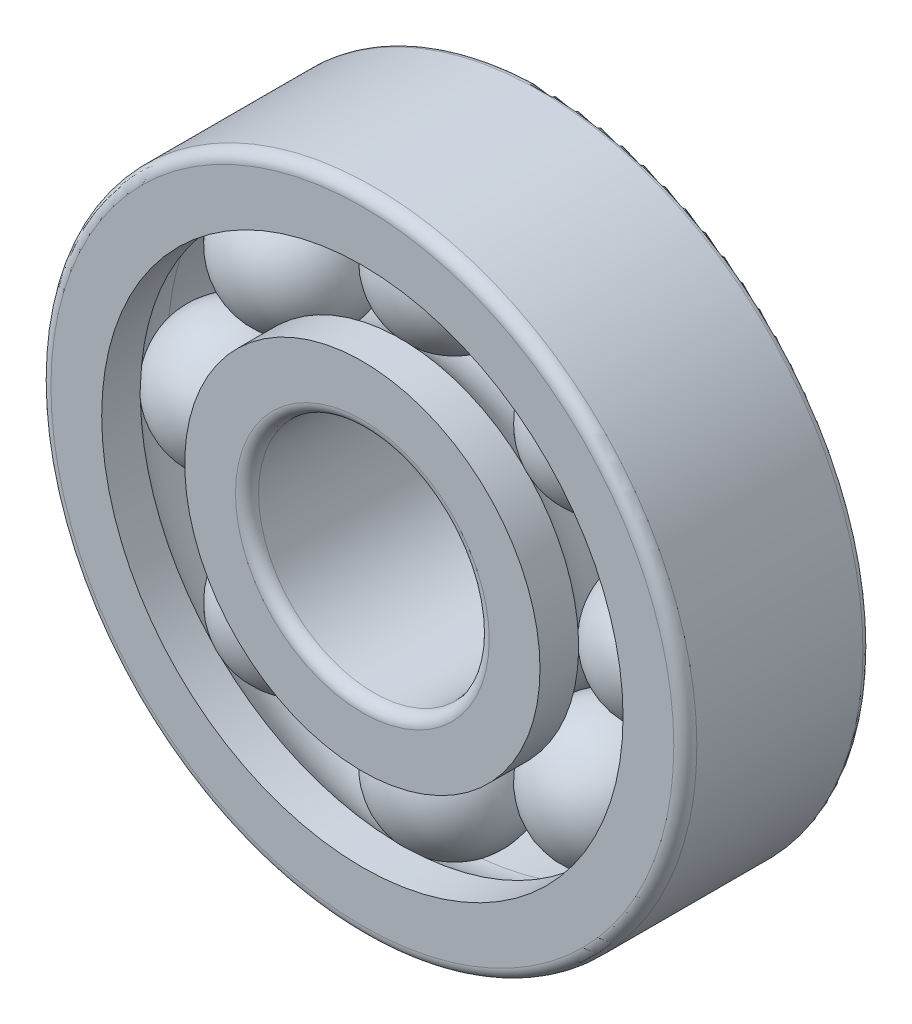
SolidWorks part; units mm, degrees
ref_plane "Front Plane" through (0, 0, 0) normal (0, 0, 1) x (1, 0, 0)
ref_plane "Top Plane" through (0, 0, 0) normal (0, 1, 0) x (1, 0, 0)
ref_plane "Right Plane" through (0, 0, 0) normal (1, 0, 0) x (0, 0, -1)
sketch "BaseSke" plane through (0, 0, 0) normal (1, 0, 0) x (0, 0, -1)
  line L0 (-47.2296, 0) -> (24.6132, 0) construction
  line L1 (-47.2296, 9.5) -> (24.6132, 9.5) construction
  line L2 (0, 129.5214) -> (0, -86.3012) construction
  line L3 (0, 12.45) -> (0, 6.55)
  line L4 (-4, 14) -> (4, 14) construction
  line L5 (-4, 5) -> (4, 5) construction
  arc A0 (0, 12.45) -> (0, 6.55) centre (0, 9.5) ccw
  dimension "D1" = 9.5
  dimension "Bearing_Thickness" = 8
  dimension "Bearing_Outside_Diameter" = 28
  dimension "Bearing_Inside_Diameter" = 10
  dimension "Ball_Outer_Diameter" = 24.9
revolve "Ball" add sketch "BaseSke" angle 360 about L3
sketch "OuterRaceSke" plane through (0, 0, 0) normal (1, 0, 0) x (0, 0, -1)
  line L0 (0, 0) -> (0, 87.5396) construction
  line L1 (-4, 14) -> (4, 14)
  line L2 (-4, 14) -> (-4, 11.3)
  line L3 (-4, 11.3) -> (-2.3246, 11.3)
  line L4 (4, 14) -> (4, 12.44)
  line L5 (-50.3916, 0) -> (55.2197, 0) construction
  line L6 (-47.2296, 9.5) -> (24.6132, 9.5) construction
  line L7 (0, 12.44) -> (4, 12.44)
  arc A0 (0, 12.44) -> (-2.3246, 11.3) centre (0, 9.5) ccw
  dimension "D2" = 24.88
  dimension "Inner_diameter" = 22.6
revolve "OuterRace" add sketch "OuterRaceSke" angle 360 about L5
sketch "InnerRaceSke" plane through (0, 0, 0) normal (1, 0, 0) x (0, 0, -1)
  line L0 (-70.8626, 0) -> (113.5527, 0) construction
  line L1 (0, 58.441) -> (0, -70.8113) construction
  line L2 (-4, 5) -> (4, 5)
  line L3 (-4, 5) -> (-4, 7.7)
  line L4 (-4, 7.7) -> (-2.3246, 7.7)
  line L5 (4, 5) -> (4, 7.7)
  line L6 (0, 129.5214) -> (0, -86.3012) construction
  line L7 (2.3246, 7.7) -> (4, 7.7)
  line L8 (-4, 14) -> (-4, 11.3) construction
  arc A0 (-2.3246, 7.7) -> (2.3246, 7.7) centre (0, 9.5) ccw
  arc A1 (0, 12.45) -> (0, 6.55) centre (0, 9.5) ccw construction
  arc A2 (0, 12.44) -> (-2.3246, 11.3) centre (0, 9.5) ccw construction
revolve "InnerRace" add sketch "InnerRaceSke" angle 360 about L0
fillet "Fillet1" radius 0.5 3 edges at (5, 0, -4) (5, 0, 4) (14, 0, 4)
fillet "Fillet2" radius 0.3 1 edges at (14, 0, -4)
pattern_circular "CirPatternBall" count 8 over 360 about axis through (0, 0, 0) along (0, 0, 1) of "Ball"
sketch "SimplifiedSke" plane through (0, 0, 0) normal (1, 0, 0) x (0, 0, -1)
  line L0 (37.5911, 0) -> (-37.5911, 0) construction
  circle A0 centre (0, 9.5) radius 2.95
  arc A1 (0, 12.45) -> (0, 6.55) centre (0, 9.5) ccw construction
revolve "Simplified" [suppressed] add sketch "SimplifiedSke" angle 360 about L0
equation "\"D1@BaseSke\" =  (\"Bearing_Outside_Diameter@BaseSke\"  +  \"Bearing_Inside_Diameter@BaseSke\"  )  / 4"
equation "\"D2@OuterRaceSke\" = \"Ball_Outer_Diameter@BaseSke\"-0.02"
equation "\"D1@CirPatternBall\" =  int(  pi  * ( \"Bearing_Outside_Diameter@BaseSke\" + \"Bearing_Inside_Diameter@BaseSke\" )  / 2  / \"Bearing_Thickness@BaseSke\"*1.25) -1"
